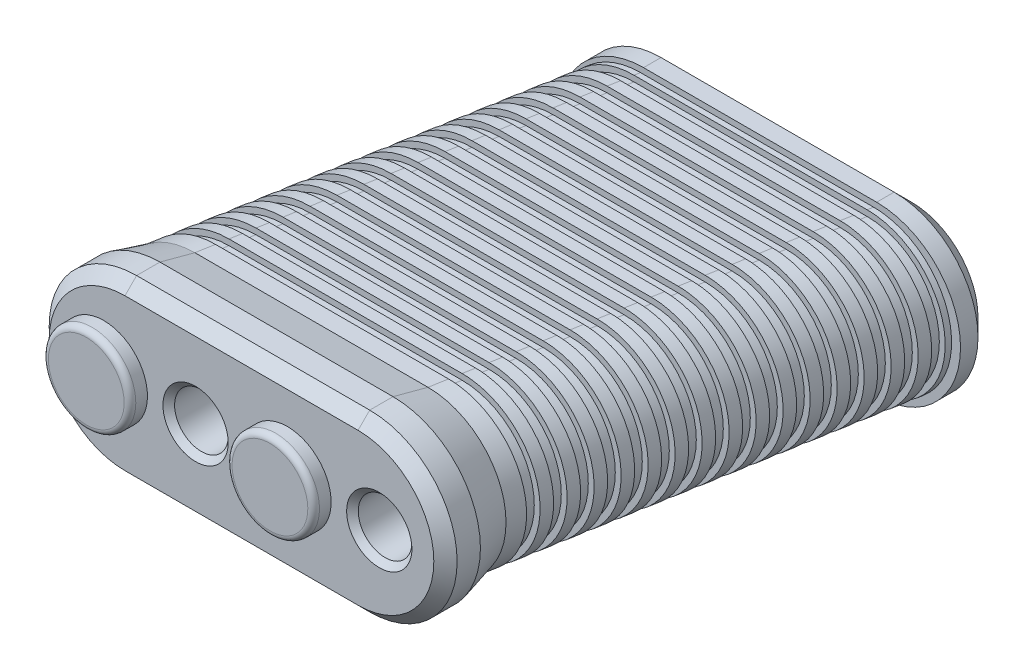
SolidWorks part; units mm, degrees
ref_plane "Front Plane" through (0, 0, 0) normal (0, 0, 1) x (1, 0, 0)
ref_plane "Top Plane" through (0, 0, 0) normal (0, 1, 0) x (1, 0, 0)
ref_plane "Right Plane" through (0, 0, 0) normal (1, 0, 0) x (0, 0, -1)
sketch "Sketch1" plane through (0, 0, 0) normal (0, 1, 0) x (1, 0, 0)
  line L0 (-12.7, 0) -> (12.7, 0) construction
  line L1 (-12.7, 9.525) -> (12.7, 9.525)
  line L2 (-12.7, -9.525) -> (12.7, -9.525)
  arc A0 (-12.7, 9.525) -> (-12.7, -9.525) centre (-12.7, 0) ccw
  arc A1 (12.7, -9.525) -> (12.7, 9.525) centre (12.7, 0) ccw
  point P2 (0, 0)
  point P10 (-22.225, 0)
  point P11 (22.225, 0)
  dimension "D1" = 19.05
  dimension "D2" = 44.45
extrude "Boss-Extrude1" add sketch "Sketch1" along normal blind 2.54
sketch "Sketch2" plane through (0, 2.54, 0) normal (0, 1, 0) x (1, 0, 0)
  line L0 (-5.0038, 0) -> (5.0038, 0) construction
  line L1 (-5.0038, 0) -> (-15.0114, 0) construction
  line L2 (5.0038, 0) -> (15.0114, 0) construction
  circle A2 centre (5.0038, 0) radius 4.7625
  circle A3 centre (-15.0114, 0) radius 4.7625
  point P4 (0, 0)
  dimension "D2" = 9.525
  dimension "D1" = 10.0076
extrude "Boss-Extrude2" add sketch "Sketch2" along normal blind 1.905
fillet "Fillet1" radius 0.635 2 edges at (5.0038, 4.445, 4.7625) (-15.0114, 4.445, 4.7625)
sketch "Sketch3" plane through (0, 2.54, 0) normal (0, 1, 0) x (1, 0, 0)
  line L0 (-15.0114, 0) -> (-5.0038, 0) construction
  line L1 (5.0038, 0) -> (15.0114, 0) construction
  circle A0 centre (-5.0038, 0) radius 2.921
  circle A1 centre (15.0114, 0) radius 2.921
  dimension "D2" = 5.842
  dimension "D1" = 10.0076
extrude "Cut-Extrude1" cut sketch "Sketch3" against normal through all both and the other way through all
sketch "Sketch6" plane through (0, 0, 0) normal (0, -1, 0) x (1, 0, 0)
  circle A0 centre (15.0114, 0) radius 2.921 construction
  circle A1 centre (-5.0038, 0) radius 2.921 construction
  circle A2 centre (15.0114, 0) radius 2.921
  circle A3 centre (-5.0038, 0) radius 2.921
  circle A4 centre (-5.0038, 0) radius 5.461
  circle A5 centre (15.0114, 0) radius 5.461
  dimension "D1" = 2.54
extrude "Boss-Extrude3" add sketch "Sketch6" along normal blind 48.26
sketch "Sketch4" plane through (0, 0, 0) normal (0, -1, 0) x (1, 0, 0)
  line L0 (-12.7, 9.525) -> (12.7, 9.525) construction
  line L1 (12.7, -9.525) -> (-12.7, -9.525) construction
  line L2 (-12.7, 9.525) -> (12.7, 9.525)
  line L3 (12.7, -9.525) -> (-12.7, -9.525)
  line L4 (12.7, -6.985) -> (6.2738, -6.985)
  line L6 (-5.0038, 0) -> (15.0114, 0) construction
  line L7 (6.2738, 6.985) -> (12.7, 6.985)
  line L8 (0.3075, -1.27) -> (3.7338, -1.27)
  line L9 (0.3075, -1.27) -> (0.3075, 1.27)
  line L10 (0.3075, 1.27) -> (3.7338, 1.27)
  line L11 (9.7001, -1.27) -> (9.7001, 1.27)
  line L12 (0.3075, -1.27) -> (9.7001, 1.27) construction
  line L13 (0.3075, 1.27) -> (9.7001, -1.27) construction
  line L15 (3.7338, -6.985) -> (3.7338, -1.27)
  line L17 (6.2738, -6.985) -> (6.2738, -1.27)
  line L18 (3.7338, -6.985) -> (6.2738, 6.985) construction
  line L19 (3.7338, 6.985) -> (6.2738, -6.985) construction
  line L20 (3.7338, -6.985) -> (-11.5851, -6.985)
  line L21 (-12.7, 6.985) -> (12.7, 6.985) construction
  line L22 (6.2738, 1.27) -> (6.2738, 6.985)
  line L23 (12.7, -6.985) -> (-12.7, -6.985) construction
  line L24 (6.2738, 1.27) -> (9.7001, 1.27)
  line L25 (6.2738, -1.27) -> (9.7001, -1.27)
  line L26 (3.7338, 1.27) -> (3.7338, 6.985)
  line L27 (3.7338, -1.27) -> (6.2738, 1.27) construction
  line L28 (6.2738, -1.27) -> (3.7338, 1.27) construction
  line L29 (-11.5851, 1.27) -> (-11.5851, 6.985)
  line L30 (-22.225, 0) -> (-10.4648, 0) construction
  line L31 (-10.4648, 0) -> (-7.9248, 0) construction
  line L33 (-19.5686, -1.27) -> (-14.1251, -1.27)
  line L35 (-19.5686, 1.27) -> (-14.1251, 1.27)
  line L36 (-10.3151, -1.27) -> (-10.3151, 1.27)
  line L37 (-14.1251, -6.8381) -> (-14.1251, -1.27)
  line L39 (-11.5851, -6.985) -> (-11.5851, -1.27)
  line L42 (-11.5851, 1.27) -> (-10.3151, 1.27)
  line L43 (-14.1251, 1.27) -> (-14.1251, 6.8381)
  line L44 (-11.5851, -1.27) -> (-10.3151, -1.27)
  line L45 (-11.5851, 6.985) -> (3.7338, 6.985)
  arc A0 (-12.7, 9.525) -> (-12.7, -9.525) centre (-12.7, 0) ccw construction
  arc A1 (12.7, -9.525) -> (12.7, 9.525) centre (12.7, 0) ccw construction
  arc A2 (-12.7, 9.525) -> (-12.7, -9.525) centre (-12.7, 0) ccw
  arc A3 (12.7, -9.525) -> (12.7, 9.525) centre (12.7, 0) ccw
  arc A4 (-14.1251, 6.8381) -> (-19.5686, 1.27) centre (-12.7, 0) ccw
  arc A5 (12.7, -6.985) -> (12.7, 6.985) centre (12.7, 0) ccw
  circle A6 centre (15.0114, 0) radius 5.461 construction
  circle A7 centre (-5.0038, 0) radius 5.461 construction
  circle A8 centre (-5.0038, 0) radius 2.921 construction
  circle A9 centre (-5.0038, 0) radius 5.461 construction
  arc A10 (-19.5686, -1.27) -> (-14.1251, -6.8381) centre (-12.7, 0) ccw
  arc A12 (-12.7, 6.985) -> (-12.7, -6.985) centre (-12.7, 0) ccw construction
  point P14 (5.0038, 0)
  point P23 (5.0038, 0)
  point P34 (-16.3449, 0)
  dimension "D2" = 2.54
  dimension "D3" = 2.54
  dimension "D4" = 2.54
  dimension "D5" = 1.27
  dimension "D6" = 2.54
  dimension "D1" = 2.54
extrude "Boss-Extrude4" add sketch "Sketch4" along normal blind 5.08
chamfer "Chamfer1" distance 1.27 angle 45 4 edges at (0, 2.54, -9.525) (-22.225, 2.54, 0) (22.225, 2.54, 0) (0, 2.54, 9.525)
chamfer "Chamfer2" distance 3.81 angle 15 4 edges at (0, -5.08, -9.525) (22.225, -5.08, 0) (-22.225, -5.08, 0) (0, -5.08, 9.525)
sketch "Sketch7" plane through (0, -5.08, 0) normal (0, -1, 0) x (1, 0, 0)
  line L0 (-12.7, -8.5041) -> (12.7, -8.5041) construction
  line L1 (12.7, 8.5041) -> (-12.7, 8.5041) construction
  line L2 (-12.7, -8.5041) -> (12.7, -8.5041)
  line L3 (12.7, 8.5041) -> (-12.7, 8.5041)
  line L4 (12.7, 5.9641) -> (-12.7, 5.9641)
  line L5 (-12.7, -5.9641) -> (12.7, -5.9641)
  arc A0 (12.7, -8.5041) -> (12.7, 8.5041) centre (12.7, 0) ccw construction
  arc A1 (-12.7, 8.5041) -> (-12.7, -8.5041) centre (-12.7, 0) ccw construction
  arc A2 (12.7, -8.5041) -> (12.7, 8.5041) centre (12.7, 0) ccw
  arc A3 (-12.7, 8.5041) -> (-12.7, -8.5041) centre (-12.7, 0) ccw
  arc A4 (-12.7, 5.9641) -> (-12.7, -5.9641) centre (-12.7, 0) ccw
  arc A5 (12.7, -5.9641) -> (12.7, 5.9641) centre (12.7, 0) ccw
  dimension "D1" = 2.54
sketch "Sketch8" plane through (0, 0, 0) normal (0, 0, 1) x (1, 0, 0)
  line L0 (0, -5.08) -> (7.6138, -48.26)
  line L1 (12.7, -5.08) -> (-12.7, -5.08) construction
  line L2 (9.5504, -48.26) -> (20.4724, -48.26) construction
  dimension "D1" = 80
sweep "Sweep1" add profiles "Sketch7" path "Sketch8"
sketch "Sketch10" plane through (0, -48.26, 0) normal (0, -1, 0) x (1, 0, 0)
  line L11 (-5.0862, -11.0441) -> (20.3138, -11.0441)
  line L12 (20.3138, 11.0441) -> (-5.0862, 11.0441)
  line L13 (-5.0862, -11.0441) -> (20.3138, -11.0441)
  line L14 (20.3138, 11.0441) -> (-5.0862, 11.0441)
  line L21 (-5.0862, -7.8691) -> (20.3138, -7.8691)
  line L22 (20.3138, 7.8691) -> (-5.0862, 7.8691)
  line L23 (-5.0862, -7.8691) -> (20.3138, -7.8691)
  line L24 (20.3138, 7.8691) -> (-5.0862, 7.8691)
  arc A11 (-5.0862, 11.0441) -> (-5.0862, -11.0441) centre (-5.0862, 0) ccw
  arc A12 (20.3138, -11.0441) -> (20.3138, 11.0441) centre (20.3138, 0) ccw
  arc A13 (-5.0862, 11.0441) -> (-5.0862, -11.0441) centre (-5.0862, 0) ccw
  arc A14 (20.3138, -11.0441) -> (20.3138, 11.0441) centre (20.3138, 0) ccw
  arc A19 (-5.0862, 7.8691) -> (-5.0862, -7.8691) centre (-5.0862, 0) ccw
  arc A20 (20.3138, -7.8691) -> (20.3138, 7.8691) centre (20.3138, 0) ccw
  arc A21 (-5.0862, 7.8691) -> (-5.0862, -7.8691) centre (-5.0862, 0) ccw
  arc A22 (20.3138, -7.8691) -> (20.3138, 7.8691) centre (20.3138, 0) ccw
  dimension "D1" = 2.54
  dimension "D2" = 0.635
sketch "Sketch11" plane through (0, 0, 0) normal (0, 0, 1) x (1, 0, 0)
  line L0 (7.6138, -48.26) -> (7.3933, -47.0093)
  line L1 (20.3138, -48.26) -> (-5.0862, -48.26) construction
  dimension "D1" = 80
  dimension "D2" = 1.27
sweep "Cut-Sweep1" cut profiles "Sketch10" path "Sketch11"
sketch "Sketch12" plane through (0, 0, 0) normal (0, 0, 1) x (1, 0, 0)
  line L0 (7.3933, -47.0093) -> (0, -5.08)
  line L1 (-5.3067, -47.0093) -> (20.0933, -47.0093) construction
  line L2 (12.7, -5.08) -> (-12.7, -5.08) construction
pattern_linear "LPattern1" count 17 spacing 2.54 along (-0.1736, 0.9848, 0) of "Cut-Sweep1"
sketch "Sketch9" plane through (0, -48.26, 0) normal (0, -1, 0) x (1, 0, 0)
  line L20 (-5.0862, -9.1391) -> (20.3138, -9.1391)
  line L21 (20.3138, 9.1391) -> (-5.0862, 9.1391)
  line L22 (-5.0862, -9.1391) -> (20.3138, -9.1391)
  line L23 (20.3138, 9.1391) -> (-5.0862, 9.1391)
  arc A20 (20.3138, -9.1391) -> (20.3138, 9.1391) centre (20.3138, 0) ccw
  arc A21 (-5.0862, 9.1391) -> (-5.0862, -9.1391) centre (-5.0862, 0) ccw
  arc A22 (20.3138, -9.1391) -> (20.3138, 9.1391) centre (20.3138, 0) ccw
  arc A23 (-5.0862, 9.1391) -> (-5.0862, -9.1391) centre (-5.0862, 0) ccw
  circle A26 centre (15.0114, 0) radius 2.921 construction
  circle A27 centre (-5.0038, 0) radius 2.921 construction
  circle A28 centre (15.0114, 0) radius 2.921
  circle A29 centre (-5.0038, 0) radius 2.921
  dimension "D1" = 1.27
extrude "Boss-Extrude5" add sketch "Sketch9" against normal mid plane 3.81
chamfer "Chamfer4" distance 1.905 angle 45 4 edges at (29.4529, -50.165, 0) (7.6138, -50.165, 9.1391) (7.6138, -50.165, -9.1391) (-14.2253, -50.165, 0)
sketch "Sketch13" plane through (0, -50.165, 0) normal (0, -1, 0) x (1, 0, 0)
  circle A3 centre (-5.0038, 0) radius 5.08
  circle A4 centre (15.0114, 0) radius 5.08
  dimension "D1" = 10.16
extrude "Cut-Extrude2" cut sketch "Sketch13" against normal blind 5.08
chamfer "Chamfer5" distance 3.81 angle 45 2 edges at (15.0114, -46.355, -5.461) (-5.0038, -46.355, -5.461)
chamfer "Chamfer6" distance 0.635 angle 45 4 edges at (15.0114, -45.085, -2.921) (-5.0038, -45.085, -2.921) (-5.0038, 2.54, 2.921) (15.0114, 2.54, 2.921)
move or copy body "Body-Move/Copy1" bodies to move or copy 110 copy no rotation origin (0, -22.86, 0) rotation axis (1, 0, 0) rotation angle 90
